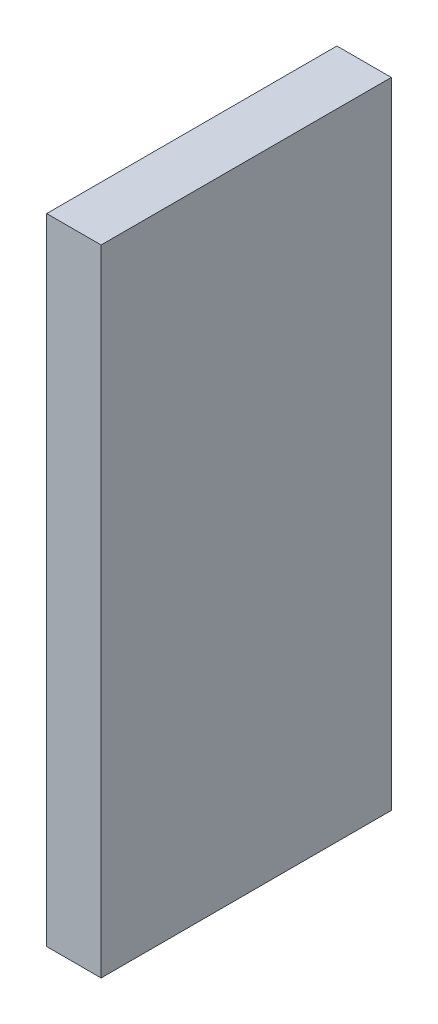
SolidWorks part; units mm, degrees
ref_plane "前视基准面" through (0, 0, 0) normal (0, 0, 1) x (1, 0, 0)
ref_plane "上视基准面" through (0, 0, 0) normal (0, 1, 0) x (1, 0, 0)
ref_plane "右视基准面" through (0, 0, 0) normal (1, 0, 0) x (0, 0, -1)
other "Configuration Table"
sketch "草图1" plane through (0, 0, 0) normal (0, 0, 1) x (1, 0, 0)
  line L1 (-24, 72) -> (-21, 72)
  line L2 (-24, 72) -> (-24, 107)
  line L3 (-24, 107) -> (-21, 107)
  line L4 (-21, 72) -> (-21, 107)
  line L5 (-24, 72) -> (-21, 107) construction
  line L6 (-24, 107) -> (-21, 72) construction
  point P0 (-22.5, 89.5)
  dimension "D1" = 21
  dimension "D2" = 22.5
  dimension "D3" = 72
  dimension "D4" = 89.5
extrude "Compliant_Contact_Pad_35x16x3" add sketch "草图1" against normal mid plane 16
